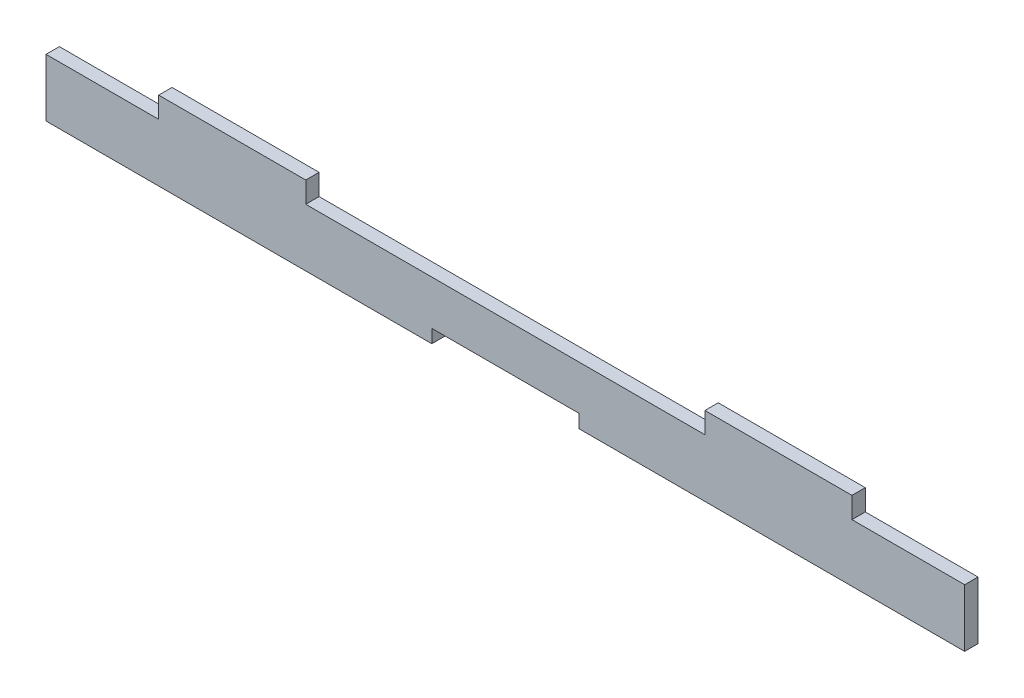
SolidWorks part; units mm, degrees
ref_plane "Front Plane" through (0, 0, 0) normal (0, 0, 1) x (1, 0, 0)
ref_plane "Top Plane" through (0, 0, 0) normal (0, 1, 0) x (1, 0, 0)
ref_plane "Right Plane" through (0, 0, 0) normal (1, 0, 0) x (0, 0, -1)
sketch "Sketch1" plane through (0, 0, 0) normal (0, 0, 1) x (1, 0, 0)
  line L0 (165, 13.75) -> (218.65, 13.75)
  line L1 (-218.65, 13.75) -> (-165, 13.75)
  line L3 (-218.65, -13.75) -> (-35, -13.75)
  line L8 (-35, -13.75) -> (-35, -7.4)
  line L9 (-35, -7.4) -> (35, -7.4)
  line L10 (35, -13.75) -> (35, -7.4)
  line L12 (-165, 13.75) -> (-165, 23.75)
  line L13 (-165, 23.75) -> (-95, 23.75)
  line L14 (-95, 13.75) -> (-95, 23.75)
  line L16 (95, 13.75) -> (95, 23.75)
  line L17 (95, 23.75) -> (165, 23.75)
  line L18 (165, 13.75) -> (165, 23.75)
  line L19 (35, -13.75) -> (218.65, -13.75)
  line L20 (-95, 13.75) -> (95, 13.75)
  line L25 (-218.65, 13.75) -> (-218.65, -13.75)
  line L29 (218.65, 13.75) -> (218.65, -13.75)
  point P0 (0, 0)
  point P3 (165, 18.75)
  dimension "D2" = 53.65
  dimension "D3" = 70
  dimension "D4" = 6.35
  dimension "D5" = 183.65
  dimension "D6" = 10
  dimension "D7" = 10
  dimension "D8" = 70
  dimension "D9" = 70
  dimension "D10" = 190
  dimension "D11" = 27.5
extrude "Boss-Extrude1" add sketch "Sketch1" along normal blind 6.35
